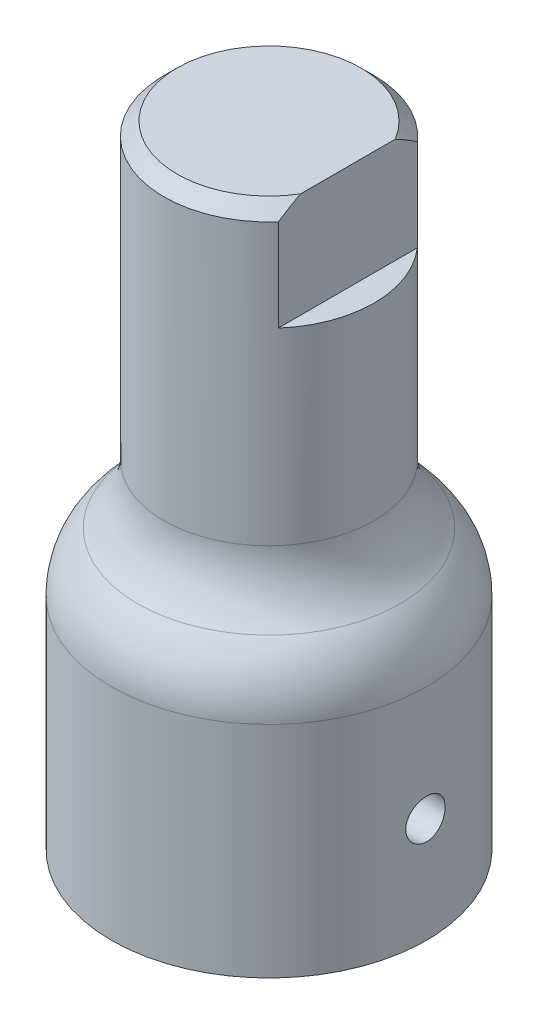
SolidWorks part; units mm, degrees
ref_plane "Front" through (0, 0, 0) normal (0, 0, 1) x (1, 0, 0)
ref_plane "Top" through (0, 0, 0) normal (0, 1, 0) x (-1, 0, 0)
ref_plane "Right" through (0, 0, 0) normal (1, 0, 0) x (0, 0, -1)
sketch "Sketch1" plane through (0, 0, 0) normal (0, 1, 0) x (-1, 0, 0)
  circle A0 centre (0, 0) radius 6.35
  dimension "D1" = 12.7
extrude "Base-Extrude" add sketch "Sketch1" along normal blind 38.1
sketch "Sketch3" plane through (0, 0, 0) normal (0, 1, 0) x (-1, 0, 0)
  circle A1 centre (0, 0) radius 9.525
  circle A2 centre (0, 0) radius 9.525
  dimension "D1" = 3.175
extrude "Boss-Extrude1" add sketch "Sketch3" along normal blind 15.875
sketch "Sketch4" plane through (0, 0, 0) normal (0, 1, 0) x (-1, 0, 0)
  line L0 (-4.7625, 4.2001) -> (-4.7625, -4.2001)
  circle A0 centre (0, 0) radius 6.35 construction
  arc A1 (-4.7625, -4.2001) -> (-4.7625, 4.2001) centre (0, 0) ccw
  dimension "D1" = 1.5875
extrude "Cut-Extrude1" cut sketch "Sketch4" along normal blind 12.7
fillet "Fillet1" radius 4.7625 1 edges at (0, 15.875, 6.35)
fillet "Fillet2" radius 4.7625 1 edges at (0, 15.875, 9.525)
sketch "Sketch5" plane through (4.7625, 0, 0) normal (-1, 0, 0) x (0, 0, 1)
  line L0 (4.2001, 0) -> (-4.2001, 0) construction
  circle A0 centre (0, 6.35) radius 1.1906
  dimension "D2" = 2.3813
  dimension "D1" = 6.35
extrude "Cut-Extrude2" cut sketch "Sketch5" against normal through all
sketch "Sketch7" plane through (0, 38.1, 0) normal (0, 1, 0) x (-1, 0, 0)
  line L0 (-4.7625, 4.2001) -> (-4.7625, -4.2001) construction
  line L1 (-4.7625, 4.2001) -> (-4.7625, -4.2001)
  circle A0 centre (0, 0) radius 6.35 construction
  arc A1 (-4.7625, 4.2001) -> (-4.7625, -4.2001) centre (0, 0) ccw
extrude "Cut-Extrude3" cut sketch "Sketch7" against normal blind 6.35
chamfer "Chamfer1" distance 0.7937 angle 45 1 edges at (-6.35, 38.1, 0)
